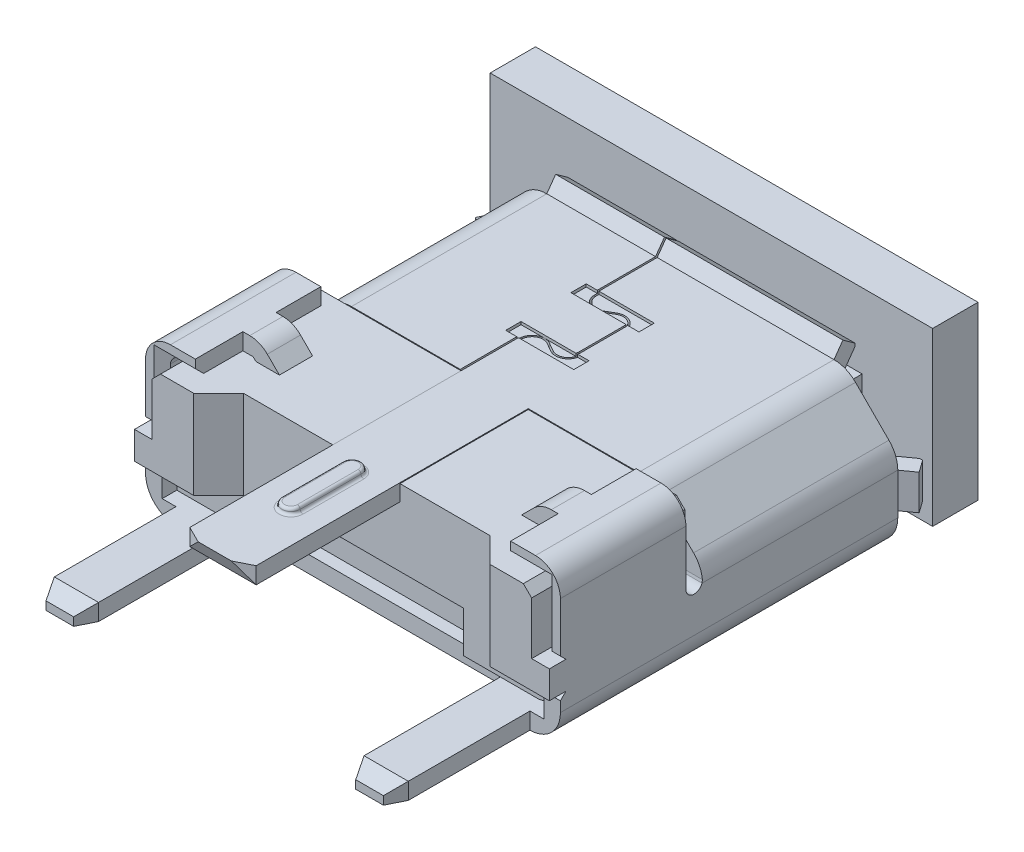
SolidWorks part; units mm, degrees
ref_plane "Front" through (0, 0, 0) normal (0, 0, 1) x (1, 0, 0)
ref_plane "Top" through (0, 0, 0) normal (0, 1, 0) x (1, 0, 0)
ref_plane "Right" through (0, 0, 0) normal (1, 0, 0) x (0, 0, -1)
imported_body "Imported3"
sketch "Sketch1" plane through (0, 0, 3.904) normal (0, 0, 1) x (1, 0, 0)
  line L0 (-3.2, 0) -> (3.2, 0)
  line L1 (3.2, 0) -> (3.2, -0.3)
  line L2 (3.2, -0.3) -> (-3.2, -0.3)
  line L3 (-3.2, -0.3) -> (-3.2, 0)
extrude "Boss-Extrude1" add sketch "Sketch1" along normal blind 1.165
ref_plane "Plane1" through (-0.83, 0, 0) normal (-1, 0, 0) x (0, -1, 0)
sketch "Sketch2" plane through (-0.83, 0, 0) normal (-1, 0, 0) x (0, -1, 0)
  line L0 (-2.15, -2.4777) -> (-2.1, -2.4777)
  line L1 (-2.1, -2.4777) -> (-2.1, -2.2011)
  line L2 (-2.1, -2.2011) -> (-2.15, -2.2011)
  line L3 (-2.15, -2.2011) -> (-2.15, -2.4777)
extrude "Cut-Extrude1" cut sketch "Sketch2" against normal up to next
sketch "Sketch3" plane through (-0.83, 0, 0) normal (-1, 0, 0) x (0, -1, 0)
  line L0 (-2.15, -1.2989) -> (-2.1, -1.2989)
  line L1 (-2.1, -1.2989) -> (-2.1, -1.0223)
  line L2 (-2.1, -1.0223) -> (-2.15, -1.0223)
  line L3 (-2.15, -1.0223) -> (-2.15, -1.2989)
extrude "Cut-Extrude2" cut sketch "Sketch3" against normal up to next
sketch "Sketch4" plane through (0, 0, 0) normal (0, 1, 0) x (-1, 0, 0)
  line L0 (-2.4, 5.069) -> (-2.4, 2.119)
  line L1 (-2.4, 2.119) -> (2.4, 2.119)
  line L2 (2.4, 2.119) -> (2.4, 5.069)
  line L3 (2.4, 5.069) -> (-2.4, 5.069)
extrude "Cut-Extrude3" cut sketch "Sketch4" against normal through all
ref_plane "Plane2" through (2.725, 0, 0) normal (1, 0, 0) x (0, 0, -1)
sketch "Sketch5" plane through (2.725, 0, 0) normal (1, 0, 0) x (0, 0, -1)
  line L0 (2.5535, -0.4424) -> (2.927, -0.5821)
  line L1 (2.927, -0.5821) -> (2.927, -0.3)
  line L2 (2.927, -0.3) -> (2.6067, -0.3)
  line L3 (2.6067, -0.3) -> (2.5535, -0.4424)
extrude "Boss-Extrude2" add sketch "Sketch5" against normal blind 0.7
ref_plane "Plane3" through (-2.025, 0, 0) normal (1, 0, 0) x (0, 0, -1)
sketch "Sketch6" plane through (-2.025, 0, 0) normal (1, 0, 0) x (0, 0, -1)
  line L0 (2.5535, -0.4424) -> (2.927, -0.5821)
  line L1 (2.927, -0.5821) -> (2.927, -0.3)
  line L2 (2.927, -0.3) -> (2.6067, -0.3)
  line L3 (2.6067, -0.3) -> (2.5535, -0.4424)
extrude "Boss-Extrude3" add sketch "Sketch6" against normal blind 0.7
sketch "Sketch7" plane through (0, 0, 2.319) normal (0, 0, 1) x (1, 0, 0)
  line L0 (1.75, 0.015) -> (1.75, 0.76)
  line L1 (1.75, 0.76) -> (-1.75, 0.76)
  line L2 (-1.75, 0.76) -> (-1.75, 0.015)
  line L3 (-1.75, 0.015) -> (1.75, 0.015)
extrude "Cut-Extrude4" cut sketch "Sketch7" against normal blind 0.4
draft "Draft1" type of draft neutral plane draft angle 35.595 faces to draft 1 parameters "D1"=35.595
draft "Draft2" type of draft neutral plane draft angle 26.338 faces to draft 1 parameters "D1"=26.338
draft "Draft3" type of draft neutral plane draft angle 26.338 faces to draft 1 parameters "D1"=26.338
draft "Draft4" type of draft neutral plane draft angle 45 faces to draft 1 parameters "D1"=45
draft "Draft5" type of draft neutral plane draft angle 45 faces to draft 1 parameters "D1"=45
draft "Draft6" type of draft neutral plane draft angle 45 faces to draft 1 parameters "D1"=45
draft "Draft7" type of draft neutral plane draft angle 45 faces to draft 1 parameters "D1"=45
draft "Draft8" type of draft neutral plane draft angle 35.595 faces to draft 1 parameters "D1"=35.595
draft "Draft9" type of draft neutral plane draft angle 35.595 faces to draft 1 parameters "D1"=35.595
draft "Draft10" type of draft neutral plane draft angle 35.595 faces to draft 1 parameters "D1"=35.595
draft "Draft11" type of draft neutral plane draft angle 78.69 faces to draft 2 parameters "D1"=78.69
draft "Draft12" type of draft neutral plane draft angle 40 faces to draft 2 parameters "D1"=40
draft "Draft13" type of draft neutral plane draft angle 20.5 faces to draft 2 parameters "D1"=20.5
draft "Draft14" type of draft neutral plane draft angle 70 faces to draft 2 parameters "D1"=70
draft "Draft15" type of draft neutral plane draft angle 45 faces to draft 2 parameters "D1"=45
draft "Draft16" type of draft neutral plane draft angle 35.595 faces to draft 3 parameters "D1"=35.595
sketch "Sketch8" plane through (0, 0, 0) normal (1, 0, 0) x (0, 0, -1)
  line L0 (-1.919, 0.61) -> (-1.919, 0.76)
  line L1 (-1.919, 0.76) -> (-2.719, 0.76)
  line L2 (-2.719, 0.76) -> (-2.719, -0.44)
  line L3 (-2.719, -0.44) -> (-2.569, -0.44)
  line L4 (-2.569, -0.44) -> (-2.569, 0.61)
  line L5 (-2.569, 0.61) -> (-1.919, 0.61)
rib "Rib1" sketch "Sketch8" sketch "Sketch8" thickness 0.25 extrusion direction parallel to sketch draft on no parameters "D1"=0.25
ref_plane "Plane4" through (-1.3, 0, 0) normal (1, 0, 0) x (0, 0, -1)
sketch "Sketch9" plane through (-1.3, 0, 0) normal (1, 0, 0) x (0, 0, -1)
  line L0 (-1.919, 0.61) -> (-1.919, 0.76)
  line L1 (-1.919, 0.76) -> (-2.719, 0.76)
  line L2 (-2.719, 0.76) -> (-2.719, -0.44)
  line L3 (-2.719, -0.44) -> (-2.569, -0.44)
  line L4 (-2.569, -0.44) -> (-2.569, 0.61)
  line L5 (-2.569, 0.61) -> (-1.919, 0.61)
rib "Rib2" sketch "Sketch9" sketch "Sketch9" thickness 0.25 extrusion direction parallel to sketch draft on no parameters "D1"=0.25
ref_plane "Plane5" through (-0.65, 0, 0) normal (1, 0, 0) x (0, 0, -1)
sketch "Sketch10" plane through (-0.65, 0, 0) normal (1, 0, 0) x (0, 0, -1)
  line L0 (-1.919, 0.61) -> (-1.919, 0.76)
  line L1 (-1.919, 0.76) -> (-2.719, 0.76)
  line L2 (-2.719, 0.76) -> (-2.719, -0.44)
  line L3 (-2.719, -0.44) -> (-2.569, -0.44)
  line L4 (-2.569, -0.44) -> (-2.569, 0.61)
  line L5 (-2.569, 0.61) -> (-1.919, 0.61)
rib "Rib3" sketch "Sketch10" sketch "Sketch10" thickness 0.25 extrusion direction parallel to sketch draft on no parameters "D1"=0.25
ref_plane "Plane6" through (0.65, 0, 0) normal (1, 0, 0) x (0, 0, -1)
sketch "Sketch11" plane through (0.65, 0, 0) normal (1, 0, 0) x (0, 0, -1)
  line L0 (-1.919, 0.61) -> (-1.919, 0.76)
  line L1 (-1.919, 0.76) -> (-2.719, 0.76)
  line L2 (-2.719, 0.76) -> (-2.719, -0.44)
  line L3 (-2.719, -0.44) -> (-2.569, -0.44)
  line L4 (-2.569, -0.44) -> (-2.569, 0.61)
  line L5 (-2.569, 0.61) -> (-1.919, 0.61)
rib "Rib4" sketch "Sketch11" sketch "Sketch11" thickness 0.25 extrusion direction parallel to sketch draft on no parameters "D1"=0.25
ref_plane "Plane7" through (1.3, 0, 0) normal (1, 0, 0) x (0, 0, -1)
sketch "Sketch12" plane through (1.3, 0, 0) normal (1, 0, 0) x (0, 0, -1)
  line L0 (-1.919, 0.61) -> (-1.919, 0.76)
  line L1 (-1.919, 0.76) -> (-2.719, 0.76)
  line L2 (-2.719, 0.76) -> (-2.719, -0.44)
  line L3 (-2.719, -0.44) -> (-2.569, -0.44)
  line L4 (-2.569, -0.44) -> (-2.569, 0.61)
  line L5 (-2.569, 0.61) -> (-1.919, 0.61)
rib "Rib5" sketch "Sketch12" sketch "Sketch12" thickness 0.25 extrusion direction parallel to sketch draft on no parameters "D1"=0.25
chamfer "Chamfer1" distance 0.15 angle 45 6 edges at (-3.43, 2.135, 1.3845) (-3.45, 1.66, 2.569) (-3.15, 2.185, 2.569) (3.43, 2.135, 1.3845) (3.45, 1.66, 2.569) (3.15, 2.185, 2.569)
fillet "Fillet2" radius 0.35 1 edges at (3.43, 0.015, 1.1595)
fillet "Fillet4" radius 0.15 1 edges at (-3.45, 2.185, 1.3595)
chamfer "Chamfer2" distance 0.05 angle 45 2 edges at (-2.375, -0.5475, -2.8345) (2.375, -0.5475, -2.8345)
chamfer "Chamfer3" distance 0.15 angle 63.435 9 edges at (3.2, -0.15, 5.069) (2.4, -0.15, 5.069) (2.8, 0, 5.069) (-0.6, 2, 5.069) (0, 1.85, 5.069) (0.6, 2, 5.069) (-3.2, -0.15, 5.069) (-2.4, -0.15, 5.069) (-2.8, 0, 5.069)
fillet "Fillet5" radius 0.45 5 edges at (0, 0.031, 0.8995) (3.75, 2.485, 1.4345) (-3.75, 2.485, 1.4345) (2.5399, 2.485, 1.4095) (-2.5399, 2.485, 1.4095)
fillet "Fillet6" radius 0.55 6 edges at (-3.75, -0.3, -0.481) (2.8243, 2.15, -1.7655) (3.75, -0.3, -0.481) (-3.75, 1.2243, -1.7655) (-2.8243, 2.15, -1.7655) (3.75, 1.2243, -1.7655)
fillet "Fillet8" radius 0.8 1 edges at (2.025, -1.3, -4.331)
fillet "Fillet9" radius 1 2 edges at (2.375, -0.15, -2.3522) (-2.375, -0.15, -2.3522)
